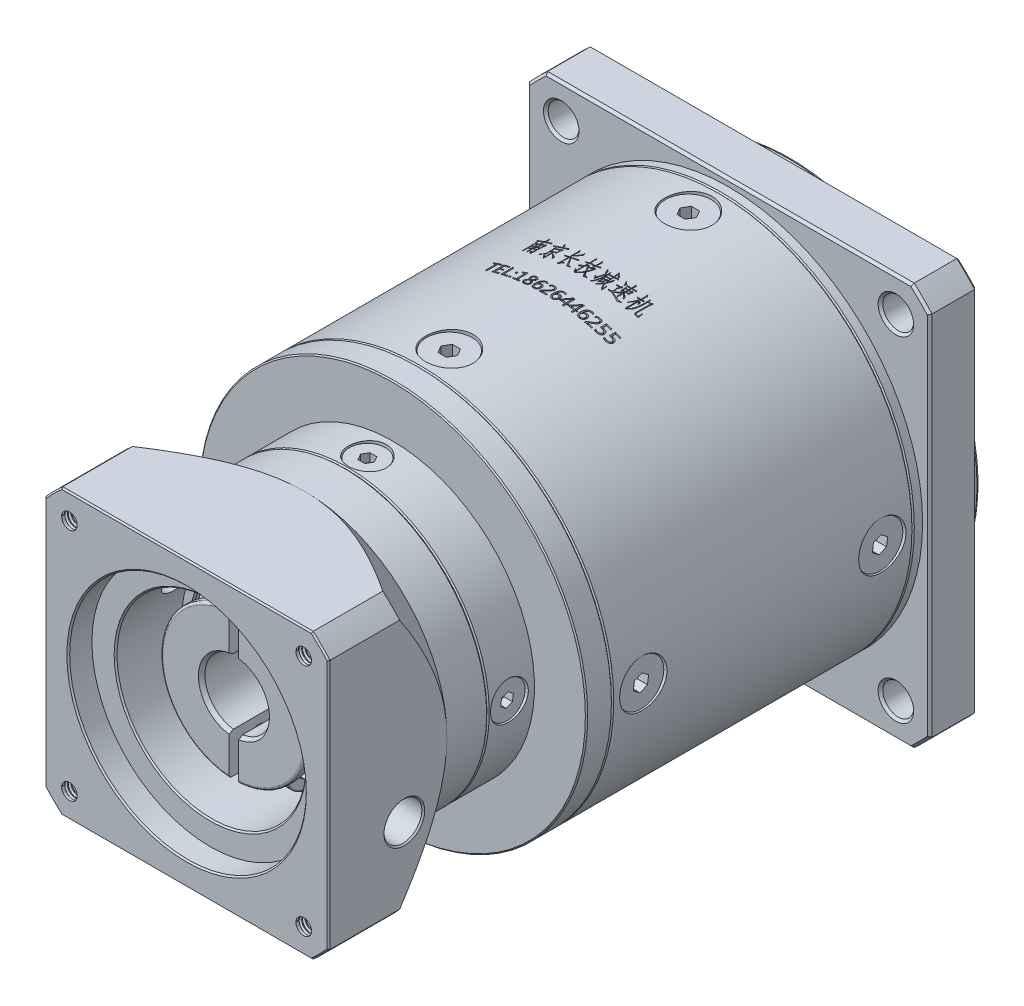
SolidWorks part; units mm, degrees
ref_plane "前视基准面" through (0, 0, 0) normal (0, 0, 1) x (1, 0, 0)
ref_plane "上视基准面" through (0, 0, 0) normal (0, 1, 0) x (1, 0, 0)
ref_plane "右视基准面" through (0, 0, 0) normal (1, 0, 0) x (0, 0, -1)
imported_body "14-50-70-M4-1-solid1"
imported_body "14-50-70-M4-1-solid2"
imported_body "14-50-70-M4-1-solid3"
imported_body "14-50-70-M4-1-solid4"
imported_body "14-50-70-M4-1-solid5"
imported_body "ZF80-K15-L3-F60-6-solid1"
imported_body "ZF80-K15-L3-F60-6-solid2"
imported_body "ZF80-K15-L3-F60-6-solid3"
imported_body "ZF80-K15-L3-F60-6-solid4"
imported_body "ZF80-K15-L3-F60-6-solid5"
imported_body "ZF80-K15-L3-F60-6-solid6"
imported_body "ZF80-K15-L3-F60-6-solid7"
imported_body "ZF80-K15-L3-F60-6-solid8"
imported_body "ZF80-K15-L3-F60-6-solid9"
imported_body "ZF80-K15-L3-F60-6-solid10"
imported_body "ZF80-K15-L3-F60-6-solid11"
imported_body "ZF80-K15-L3-F60-6-solid12"
imported_body "ZF80-K15-L3-F60-6-solid13"
sketch "草图1" plane through (0, 0, -65.8056) normal (0, 0, -1) x (-1, 0, 0)
  circle A0 centre (62.1273, 18.4518) radius 11.0261
  dimension "D1" = 22.0523
extrude "凸台-拉伸1" add sketch "草图1" along normal blind 5
